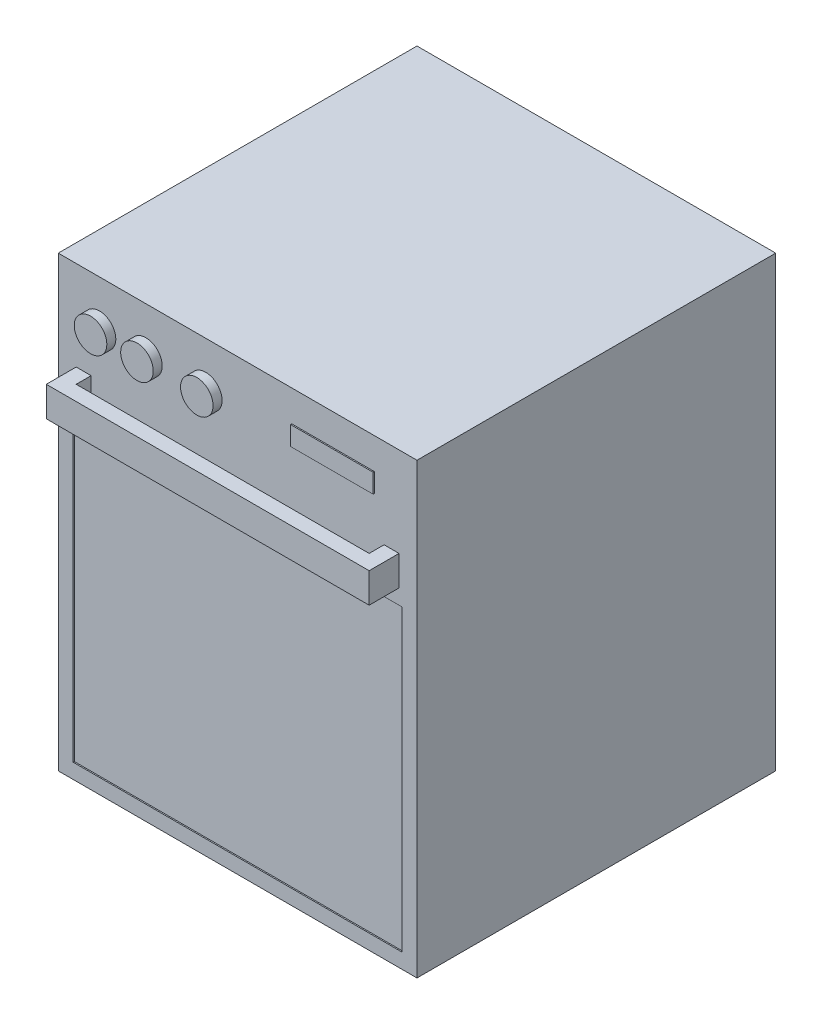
SolidWorks part; units mm, degrees
ref_plane "Plan de face" through (0, 0, 0) normal (0, 0, 1) x (1, 0, 0)
ref_plane "Plan de dessus" through (0, 0, 0) normal (0, 1, 0) x (1, 0, 0)
ref_plane "Plan de droite" through (0, 0, 0) normal (1, 0, 0) x (0, 0, -1)
sketch "Esquisse1" plane through (0, 0, 0) normal (0, 0, 1) x (1, 0, 0)
  line L1 (0, 0) -> (600, 0)
  line L2 (0, 0) -> (0, 750)
  line L3 (0, 750) -> (600, 750)
  line L4 (600, 0) -> (600, 750)
  dimension "D1" = 600
  dimension "D2" = 750
extrude "Boss.-Extru.1" add sketch "Esquisse1" along normal blind 600
sketch "Esquisse2" plane through (0, 0, 600) normal (0, 0, 1) x (1, 0, 0)
  line L0 (600, 0) -> (600, 750) construction
  line L1 (30, 600) -> (570, 600)
  line L2 (30, 600) -> (30, 550)
  line L3 (30, 550) -> (570, 550)
  line L4 (570, 600) -> (570, 550)
  line L5 (0, 750) -> (0, 0) construction
  line L6 (600, 750) -> (0, 750) construction
  dimension "D1" = 50
  dimension "D2" = 30
  dimension "D3" = 30
  dimension "D4" = 150
extrude "Boss.-Extru.2" add sketch "Esquisse2" along normal blind 50
sketch "Esquisse3" plane through (0, 600, 0) normal (0, 1, 0) x (1, 0, 0)
  line L0 (600, -600) -> (0, -600) construction
  line L1 (55, -600) -> (545, -600)
  line L2 (55, -600) -> (55, -625)
  line L3 (55, -625) -> (545, -625)
  line L4 (545, -600) -> (545, -625)
  line L5 (30, -650) -> (30, -600) construction
  line L6 (570, -650) -> (570, -600) construction
  line L7 (570, -650) -> (30, -650) construction
  dimension "D1" = 25
  dimension "D2" = 25
  dimension "D3" = 25
extrude "Enlèv. mat.-Extru.1" cut sketch "Esquisse3" against normal blind 50
sketch "Esquisse4" plane through (0, 0, 600) normal (0, 0, 1) x (1, 0, 0)
  line L0 (600, 0) -> (600, 750) construction
  line L1 (25, 525) -> (575, 525)
  line L2 (25, 525) -> (25, 25)
  line L3 (25, 25) -> (575, 25)
  line L4 (575, 525) -> (575, 25)
  line L5 (0, 750) -> (0, 0) construction
  line L6 (0, 0) -> (600, 0) construction
  line L7 (30, 550) -> (570, 550) construction
  dimension "D1" = 25
  dimension "D2" = 25
  dimension "D3" = 25
  dimension "D4" = 25
extrude "Enlèv. mat.-Extru.2" cut sketch "Esquisse4" against normal blind 2
sketch "Esquisse5" plane through (0, 0, 600) normal (0, 0, 1) x (1, 0, 0)
  circle A0 centre (69.0094, 673.5127) radius 27.2366
  circle A1 centre (146.6356, 673.5127) radius 27.2366
  circle A2 centre (246.7478, 673.5127) radius 27.2366
extrude "Boss.-Extru.3" add sketch "Esquisse5" along normal blind 15
sketch "Esquisse6" plane through (0, 0, 600) normal (0, 0, 1) x (1, 0, 0)
  line L1 (528.7168, 666.1229) -> (390.3328, 666.1229)
  line L2 (528.7168, 666.1229) -> (528.7168, 697.939)
  line L3 (528.7168, 697.939) -> (390.3328, 697.939)
  line L4 (390.3328, 666.1229) -> (390.3328, 697.939)
extrude "Boss.-Extru.4" add sketch "Esquisse6" along normal blind 2
